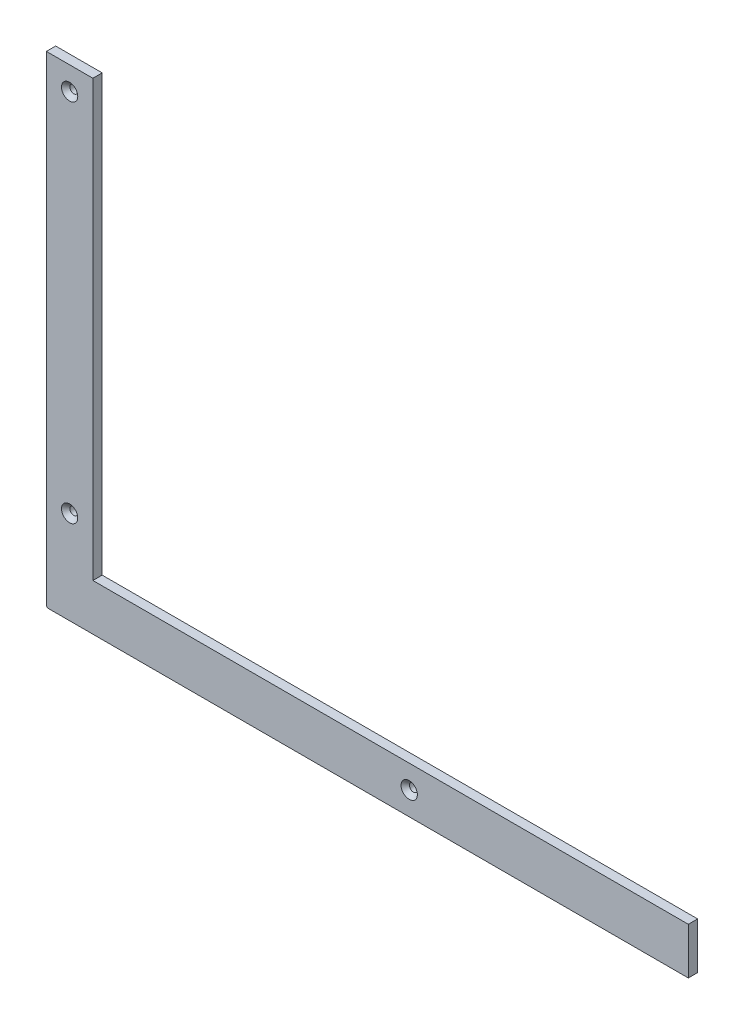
SolidWorks part; units mm, degrees
ref_plane "Ebene vorne" through (0, 0, 0) normal (0, 0, 1) x (1, 0, 0)
ref_plane "Ebene oben" through (0, 0, 0) normal (0, 1, 0) x (1, 0, 0)
ref_plane "Ebene rechts" through (0, 0, 0) normal (1, 0, 0) x (0, 0, -1)
sketch "Skizze1" plane through (0, 0, 0) normal (0, 0, 1) x (1, 0, 0)
  line L1 (-246, -177) -> (246, -177)
  line L2 (-246, -177) -> (-246, 177)
  line L3 (-246, 177) -> (246, 177)
  line L4 (246, -177) -> (246, 177)
  line L5 (-246, -177) -> (246, 177) construction
  line L6 (-246, 177) -> (246, -177) construction
  line L7 (-266, -197) -> (266, -197)
  line L8 (-266, -197) -> (-266, 197)
  line L9 (-266, 197) -> (266, 197)
  line L10 (266, -197) -> (266, 197)
  line L11 (-266, -197) -> (266, 197) construction
  line L12 (-266, 197) -> (266, -197) construction
  point P0 (0, 0)
  point P6 (0, 0)
  dimension "D1" = 532
  dimension "D2" = 394
  dimension "D3" = 20
  dimension "D4" = 20
extrude "Aufsatz-Linear austragen1" add sketch "Skizze1" along normal blind 8
fillet "Verrundung1" radius 1 4 edges at (-266, 197, 4) (-266, -197, 4) (266, -197, 4) (266, 197, 4)
sketch "Skizze2" plane through (0, 0, 0) normal (0, 0, -1) x (-1, 0, 0)
  line L0 (-266, -196) -> (-266, 196) construction
  line L1 (-258.5, 189.5) -> (258.5, 189.5)
  line L2 (-258.5, 189.5) -> (-258.5, -189.5)
  line L3 (-258.5, -189.5) -> (258.5, -189.5)
  line L4 (258.5, 189.5) -> (258.5, -189.5)
  line L5 (-265, 197) -> (265, 197) construction
  line L6 (266, 196) -> (266, -196) construction
  line L7 (265, -197) -> (-265, -197) construction
  dimension "D1" = 7.5
  dimension "D2" = 7.5
  dimension "D3" = 7.5
  dimension "D4" = 7.5
extrude "Schnitt-Linear austragen1" cut sketch "Skizze2" against normal blind 4
hole_wizard "Formsenkung für M3 Senkschraube mit Innensechskant1" positions "Skizze3" profile "Skizze4" countersink size "M3" standard "DIN"
sketch "Skizze3" plane through (0, 0, 8) normal (0, 0, 1) x (1, 0, 0)
  line L0 (-266, 196) -> (-266, -196) construction
  line L1 (266, -196) -> (266, 196) construction
  line L2 (-265, -197) -> (265, -197) construction
  line L3 (265, 197) -> (-265, 197) construction
  point P0 (-110, -187)
  point P2 (110, -187)
  point P4 (110, 187)
  point P6 (-110, 187)
  point P8 (256, 157)
  point P10 (256, -157)
  point P12 (-256, -157)
  point P14 (-256, 157)
  point P26 (-256, 0)
  point P32 (256, 0)
  dimension "D1" = 156
  dimension "D2" = 156
  dimension "D3" = 10
  dimension "D4" = 10
  dimension "D5" = 10
  dimension "D6" = 10
  dimension "D7" = 40
  dimension "D8" = 40
sketch "Skizze4" plane through (-110, -187, 8) normal (1, 0, 0) x (0, -1, 0)
  line L0 (0, 0) -> (0, 8)
  line L1 (0, 8) -> (1.7, 8)
  line L2 (1.7, 8) -> (1.7, 1.8)
  line L3 (1.7, 1.8) -> (3.5, 0)
  line L5 (3.5, 0) -> (0, 0)
  line L6 (-1.7, 1.8) -> (-3.5, 0) construction
  line L11 (0, -6.35) -> (0, 107.95) construction
  dimension "Bohrerdurchmesser" = 3.4
  dimension "Bohrungstiefe" = 8
  dimension "Senkdurchmesser (Oben)" = 7
  dimension "Senkwinkel (Oben)" = 90
sketch "Skizze5" plane through (0, 0, 0) normal (1, 0, 0) x (0, 0, -1)
  line L0 (-8, 197) -> (-8, 10)
  line L1 (-8, -196) -> (-8, 196) construction
  line L2 (-8, 10) -> (-4, 10)
  line L3 (-4, 10) -> (-4, -10)
  line L4 (-4, -10) -> (0, -10)
  line L5 (0, -196) -> (0, 196) construction
  line L6 (0, -10) -> (0, 197)
  line L7 (0, 197) -> (-8, 197)
  dimension "D1" = 10
  dimension "D2" = 10
  dimension "D3" = 4
extrude "Schnitt-Linear austragen2" cut sketch "Skizze5" against normal through all
sketch "Skizze6" plane through (0, 0, 0) normal (1, 0, 0) x (0, 0, -1)
  line L0 (-8, 197) -> (-8, -10)
  line L1 (-8, -196) -> (-8, 196) construction
  line L2 (-8, -10) -> (-4, -10)
  line L3 (-4, -10) -> (-4, 10)
  line L4 (-4, 10) -> (0, 10)
  line L5 (0, -196) -> (0, 196) construction
  line L6 (0, 10) -> (0, 197)
  line L7 (0, 197) -> (-8, 197)
  dimension "D1" = 10
  dimension "D2" = 4
  dimension "D3" = 10
extrude "Schnitt-Linear austragen3" cut sketch "Skizze6" along normal through all
sketch "Skizze7" plane through (0, 0, 0) normal (0, 1, 0) x (1, 0, 0)
  line L0 (266, -8) -> (10, -8)
  line L1 (-246, -8) -> (246, -8) construction
  line L2 (10, -8) -> (10, -4)
  line L3 (246, -4) -> (-246, -4) construction
  line L4 (10, -4) -> (-10, -4)
  line L5 (-10, -4) -> (-10, 0)
  line L6 (258.5, 0) -> (-258.5, 0) construction
  line L7 (-10, 0) -> (266, 0)
  line L8 (266, 0) -> (266, -8)
  dimension "D1" = 10
  dimension "D2" = 10
extrude "Schnitt-Linear austragen4" cut sketch "Skizze7" against normal through all both and the other way through all
